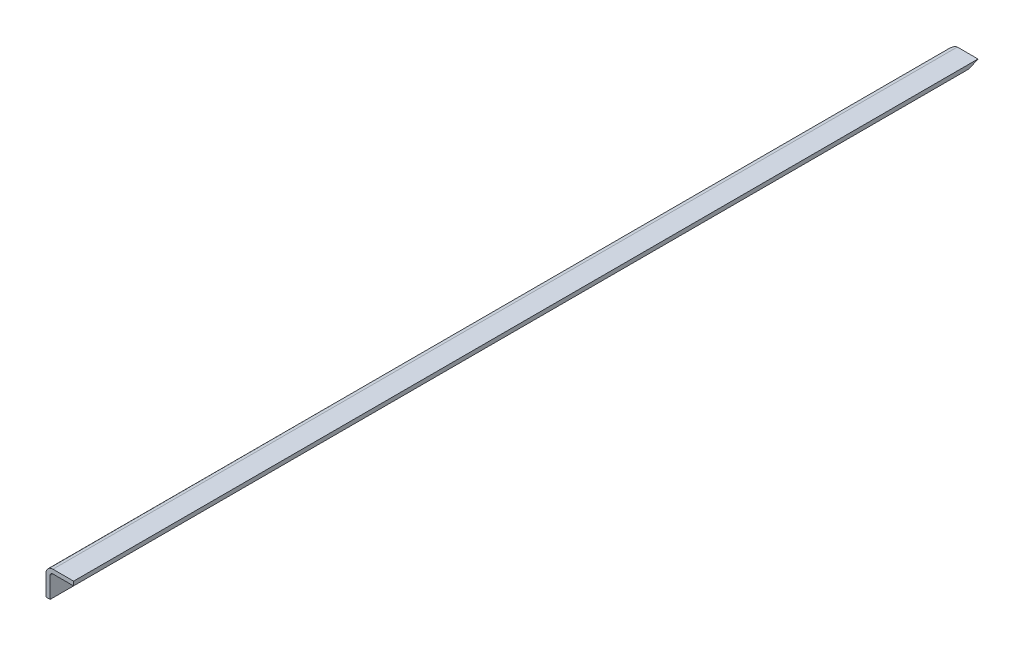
SolidWorks part; units mm, degrees
ref_plane "Plan de face" through (0, 0, 0) normal (0, 0, 1) x (1, 0, 0)
ref_plane "Plan de dessus" through (0, 0, 0) normal (0, 1, 0) x (1, 0, 0)
ref_plane "Plan de droite" through (0, 0, 0) normal (1, 0, 0) x (0, 0, -1)
sketch "Esquisse1" plane through (0, 0, 0) normal (0, 0, 1) x (1, 0, 0)
  line L0 (0, 0) -> (0, 60)
  line L1 (20, 80) -> (80, 80)
  line L2 (80, 80) -> (80, 68)
  line L3 (80, 68) -> (20, 68)
  line L4 (12, 60) -> (12, 0)
  line L5 (12, 0) -> (0, 0)
  arc A0 (0, 60) -> (20, 80) centre (20, 60) cw
  arc A1 (20, 68) -> (12, 60) centre (20, 60) ccw
  point P9 (0, 80)
  dimension "D5" = 20
  dimension "D6" = 8
  dimension "D1" = 80
  dimension "D2" = 80
  dimension "D3" = 12
  dimension "D4" = 12
extrude "Extrusion1" add sketch "Esquisse1" along normal blind 2750
sketch "Esquisse3" plane through (80, 0, 0) normal (1, 0, 0) x (0, 0, -1)
  line L0 (0, 0) -> (0, 140)
  line L1 (0, 140) -> (-300, 0)
  line L2 (-2750, 0) -> (0, 0) construction
  line L3 (-300, 0) -> (0, 0)
  dimension "D1" = 140
  dimension "D2" = 300
extrude "Enlèv. mat.-Extru.2" cut sketch "Esquisse3" against normal blind 80
